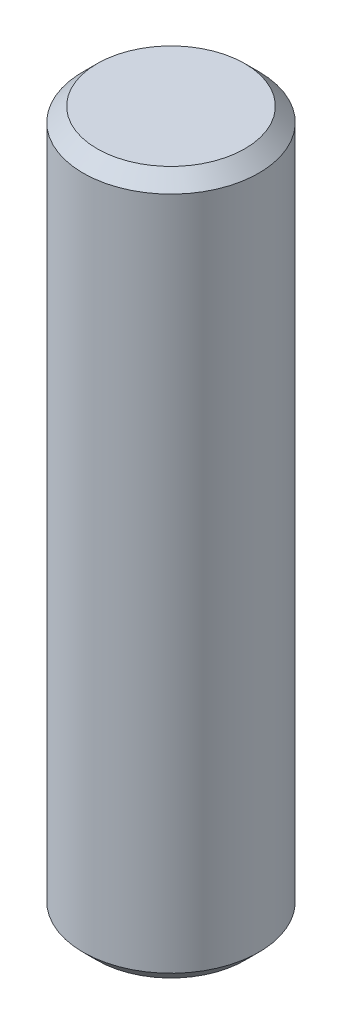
SolidWorks part; units mm, degrees
ref_plane "Front Plane" through (0, 0, 0) normal (0, 0, 1) x (1, 0, 0)
ref_plane "Top Plane" through (0, 0, 0) normal (0, 1, 0) x (1, 0, 0)
ref_plane "Right Plane" through (0, 0, 0) normal (1, 0, 0) x (0, 0, -1)
sketch "Sketch1" plane through (0, 0, 0) normal (0, 1, 0) x (1, 0, 0)
  circle A0 centre (0, 0) radius 9.5275
  dimension "D1" = 19.0551
extrude "Extrude1" add sketch "Sketch1" along normal mid plane 76.2
chamfer "Chamfer1" distance 1.524 angle 45 2 edges at (0, -38.1, 9.5275) (0, 38.1, 9.5275)
